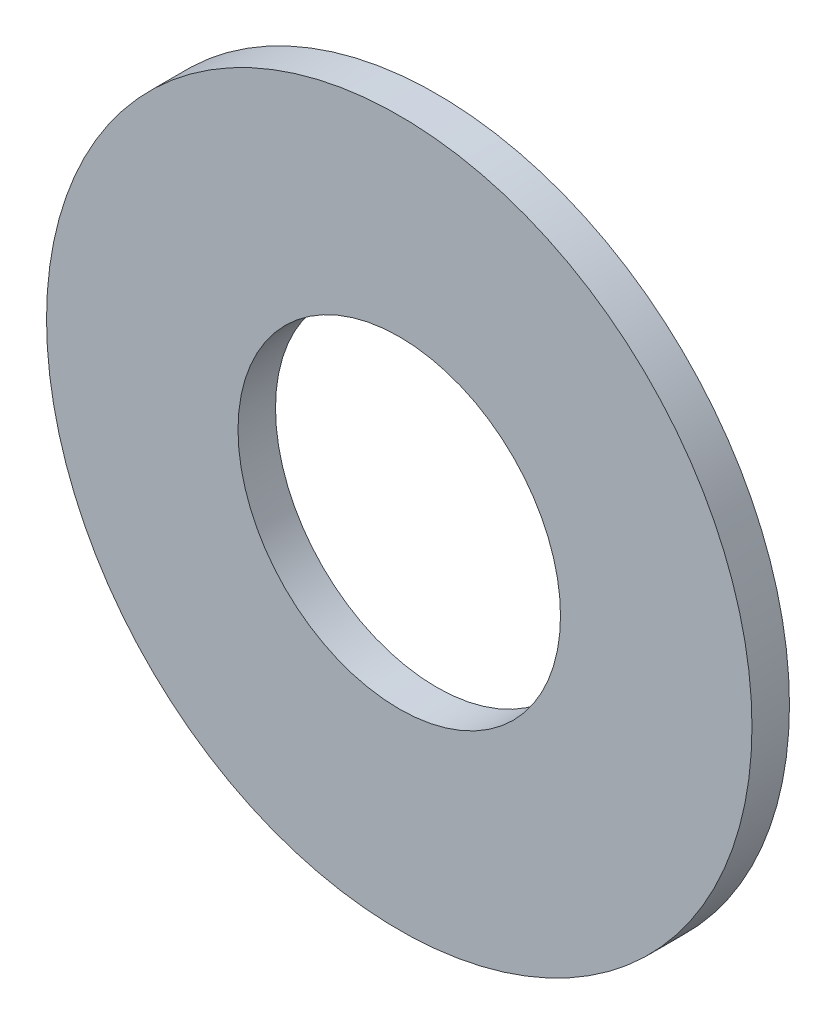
SolidWorks part; units mm, degrees
ref_plane "Plane1" through (0, 0, 0) normal (0, 0, 1) x (1, 0, 0)
ref_plane "Plane2" through (0, 0, 0) normal (0, 1, 0) x (1, 0, 0)
ref_plane "Plane3" through (0, 0, 0) normal (1, 0, 0) x (0, 0, -1)
sketch "Sketch1" plane through (0, 0, 0) normal (0, 0, 1) x (1, 0, 0)
  circle A0 centre (0, 0) radius 5.08
  circle A1 centre (0, 0) radius 11.1125
extrude "Base-Extrude" add sketch "Sketch1" against normal blind 1.1811
